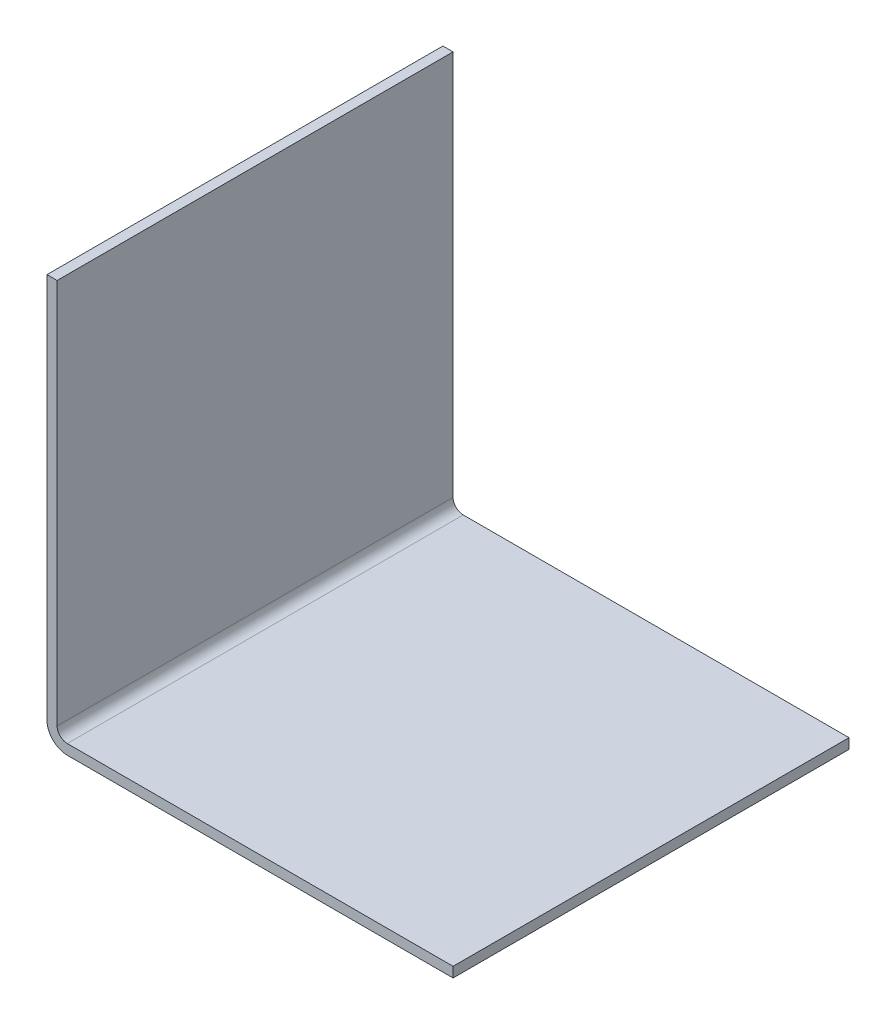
SolidWorks part; units mm, degrees
ref_plane "前视基准面" through (0, 0, 0) normal (0, 0, 1) x (1, 0, 0)
ref_plane "上视基准面" through (0, 0, 0) normal (0, 1, 0) x (1, 0, 0)
ref_plane "右视基准面" through (0, 0, 0) normal (1, 0, 0) x (0, 0, -1)
sketch "草图1" plane through (0, 0, 0) normal (0, 0, 1) x (1, 0, 0)
  line L0 (2, 0) -> (40, 0)
  line L1 (40, 0) -> (40, 1)
  line L2 (40, 1) -> (2, 1)
  line L3 (1, 2) -> (1, 40)
  line L4 (1, 40) -> (0, 40)
  line L5 (0, 40) -> (0, 2)
  arc A0 (2, 0) -> (0, 2) centre (2, 2) cw
  arc A1 (2, 1) -> (1, 2) centre (2, 2) cw
  point P9 (0, 0)
  dimension "D5" = 2
  dimension "D6" = 1
  dimension "D1" = 1
  dimension "D2" = 40
  dimension "D3" = 1
  dimension "D4" = 40
extrude "凸台-拉伸1" add sketch "草图1" along normal blind 39
